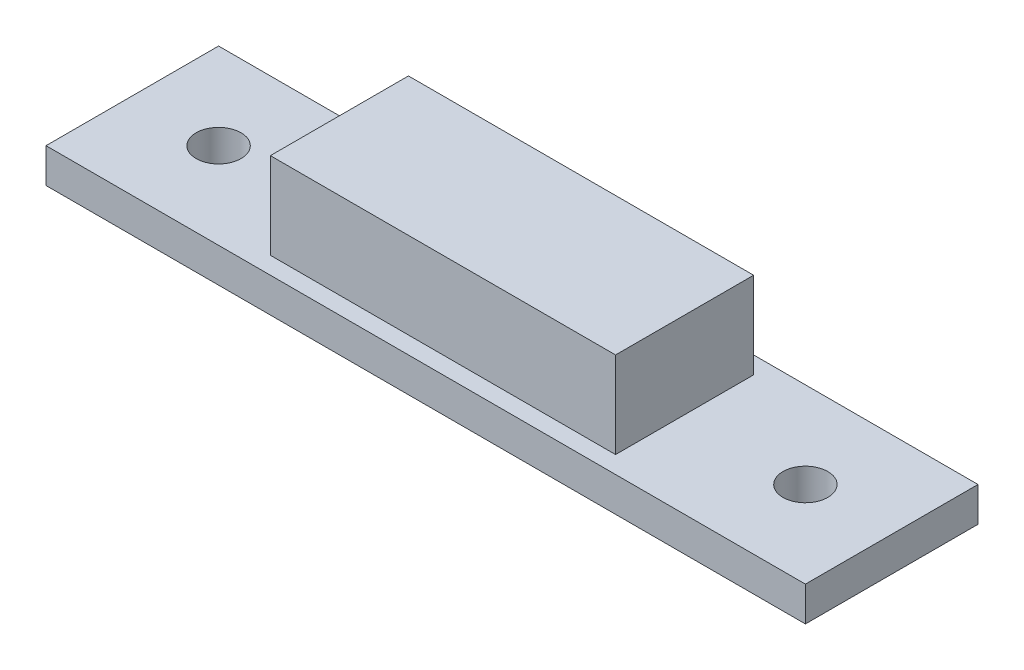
SolidWorks part; units mm, degrees
ref_plane "Plan de face" through (0, 0, 0) normal (0, 0, 1) x (1, 0, 0)
ref_plane "Plan de dessus" through (0, 0, 0) normal (0, 1, 0) x (1, 0, 0)
ref_plane "Plan de droite" through (0, 0, 0) normal (1, 0, 0) x (0, 0, -1)
sketch "Esquisse1" plane through (0, 0, 0) normal (0, 1, 0) x (1, 0, 0)
  line L1 (-110, 25) -> (110, 25)
  line L2 (-110, 25) -> (-110, -25)
  line L3 (-110, -25) -> (110, -25)
  line L4 (110, 25) -> (110, -25)
  point P4 (0, 25)
  point P6 (-110, 0)
  dimension "D1" = 220
  dimension "D2" = 50
extrude "Extrusion1" add sketch "Esquisse1" along normal blind 10
sketch "Esquisse2" plane through (0, 10, 0) normal (0, 1, 0) x (1, 0, 0)
  line L0 (-110, -25) -> (110, -25) construction
  line L1 (-50, 20) -> (50, 20)
  line L2 (-50, 20) -> (-50, -20)
  line L3 (-50, -20) -> (50, -20)
  line L4 (50, 20) -> (50, -20)
  point P4 (0, 20)
  point P6 (-50, 0)
  dimension "D1" = 5
  dimension "D2" = 100
extrude "Extrusion2" add sketch "Esquisse2" along normal blind 25 separate body
sketch "Esquisse3" plane through (0, 10, 0) normal (0, 1, 0) x (1, 0, 0)
  line L0 (-110, 25) -> (-110, -25) construction
  circle A0 centre (-85, 0) radius 6.5
  circle A1 centre (85, 0) radius 6.5
  dimension "D3" = 13
  dimension "D1" = 25
  dimension "D2" = 170
extrude "Enlèv. mat.-Extru.1" cut sketch "Esquisse3" against normal blind 25
